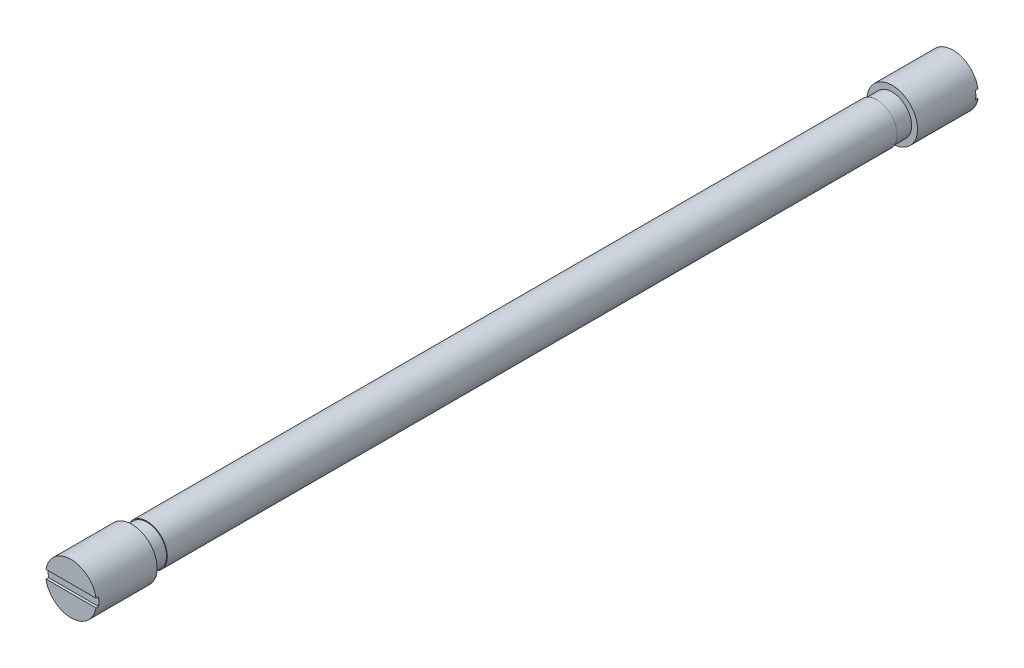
SolidWorks part; units mm, degrees
ref_plane "Plan de face" through (0, 0, 0) normal (0, 0, 1) x (1, 0, 0)
ref_plane "Plan de dessus" through (0, 0, 0) normal (0, 1, 0) x (1, 0, 0)
ref_plane "Plan de droite" through (0, 0, 0) normal (1, 0, 0) x (0, 0, -1)
sketch "Esquisse2" plane through (0, 0, 0) normal (1, 0, 0) x (0, 0, -1)
  line L0 (-75, 0) -> (-87, 0)
  line L1 (-51, 0) -> (51, 0)
  line L2 (0, 0) -> (0, 4)
  line L3 (-51, 4) -> (51, 4)
  line L4 (51, 0) -> (51, 4)
  line L5 (51, 0) -> (72, 0)
  line L6 (51, 0) -> (51, 4)
  line L7 (51, 4) -> (72, 4)
  line L8 (72, 0) -> (72, 4)
  line L9 (72, 0) -> (75, 0)
  line L10 (72, 0) -> (72, 3.85)
  line L11 (72, 3.85) -> (75, 3.85)
  line L12 (75, 0) -> (75, 3.85)
  line L13 (75, 0) -> (87, 0)
  line L14 (75, 0) -> (75, 5)
  line L15 (75, 5) -> (87, 5)
  line L16 (87, 0) -> (87, 5)
  line L17 (-87, 0) -> (-87, 5)
  line L18 (-75, 0) -> (-75, 5)
  line L19 (-72, 0) -> (-72, 4)
  line L20 (-75, 5) -> (-87, 5)
  line L21 (-75, 0) -> (-75, 3.85)
  line L22 (-72, 0) -> (-75, 0)
  line L23 (-72, 3.85) -> (-75, 3.85)
  line L24 (-51, 0) -> (-72, 0)
  line L25 (-51, 4) -> (-72, 4)
  line L26 (-51, 0) -> (-51, 4)
  dimension "D1" = 51
  dimension "D2" = 4
  dimension "D3" = 21
  dimension "D4" = 4
  dimension "D5" = 3
  dimension "D6" = 12
  dimension "D7" = 3.85
  dimension "D8" = 5
revolve "Révolution1" add sketch "Esquisse2" angle 360 about L1
sketch "Esquisse4" plane through (0, 0, -87) normal (0, 0, -1) x (-1, 0, 0)
  line L1 (-5.8333, -0.8316) -> (5.8333, -0.8316)
  line L2 (-5.8333, -0.8316) -> (-5.8333, 0.8316)
  line L3 (-5.8333, 0.8316) -> (5.8333, 0.8316)
  line L4 (5.8333, -0.8316) -> (5.8333, 0.8316)
  line L5 (-5.8333, -0.8316) -> (5.8333, 0.8316) construction
  line L6 (-5.8333, 0.8316) -> (5.8333, -0.8316) construction
  point P0 (0, 0)
extrude "Enlèv. mat.-Extru.2" cut sketch "Esquisse4" against normal blind 0.5
mirror "Symétrie2" about plane through (0, 0, 0) normal (0, 0, 1) of "Enlèv. mat.-Extru.2"
